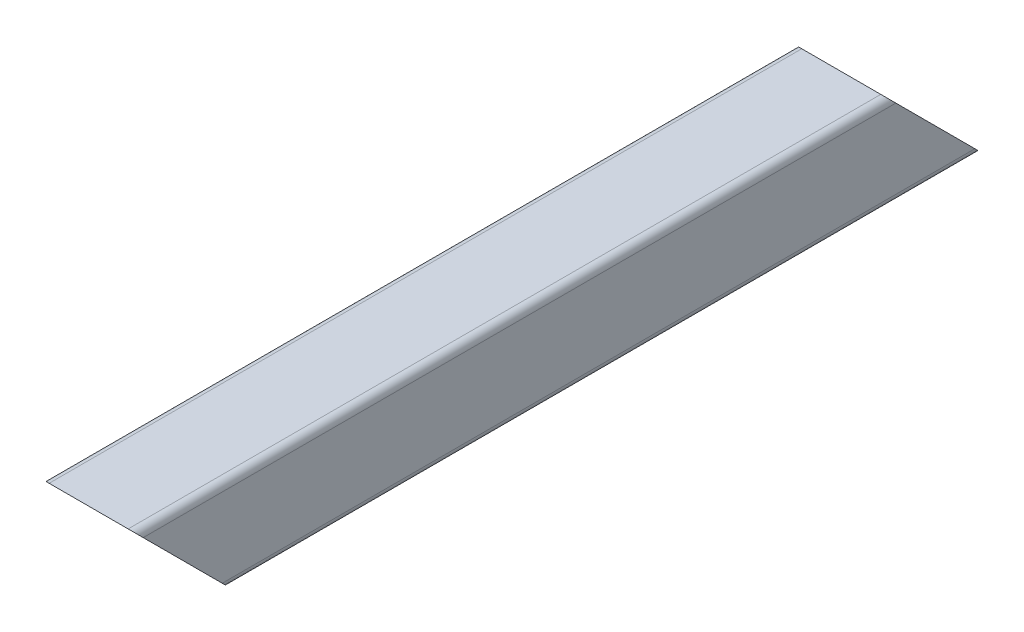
SolidWorks part; units mm, degrees
ref_plane "Face" through (0, 0, 0) normal (0, 0, 1) x (1, 0, 0)
ref_plane "Dessus" through (0, 0, 0) normal (0, 1, 0) x (1, 0, 0)
ref_plane "Droite" through (0, 0, 0) normal (1, 0, 0) x (0, 0, -1)
sketch "Esquisse1" plane through (0, 0, 0) normal (0, 0, 1) x (1, 0, 0)
  line L0 (3, -4) -> (3, -46)
  line L1 (4, 0) -> (46, 0)
  line L2 (0, -4) -> (0, -46)
  line L3 (4, -50) -> (46, -50)
  line L4 (50, -4) -> (50, -46)
  line L5 (4, -47) -> (46, -47)
  line L6 (47, -4) -> (47, -46)
  line L7 (4, -3) -> (46, -3)
  arc A0 (0, -4) -> (4, 0) centre (4, -4) cw
  arc A1 (4, -50) -> (0, -46) centre (4, -46) cw
  arc A2 (50, -46) -> (46, -50) centre (46, -46) cw
  arc A3 (46, 0) -> (50, -4) centre (46, -4) cw
  arc A4 (4, -47) -> (3, -46) centre (4, -46) cw
  arc A5 (47, -46) -> (46, -47) centre (46, -46) cw
  arc A6 (46, -3) -> (47, -4) centre (46, -4) cw
  arc A7 (3, -4) -> (4, -3) centre (4, -4) cw
  point P7 (0, 0)
  point P10 (0, -50)
  point P15 (50, 0)
  dimension "D3" = 4
  dimension "D1" = 50
  dimension "D2" = 50
  dimension "D4" = 3
extrude "Base-Extrusion" add sketch "Esquisse1" along normal blind 450
sketch "Esquisse2" plane through (0, 0, 0) normal (-1, 0, 0) x (0, 0, 1)
  line L0 (450, 0) -> (400, -50)
  line L1 (0, -50) -> (50, 0)
  line L2 (450, 0) -> (450, -50)
  line L3 (450, -50) -> (400, -50)
  line L4 (0, -50) -> (0, 0)
  line L5 (0, 0) -> (50, 0)
  line L6 (450, -4) -> (450, -46) construction
  line L7 (450, -50) -> (0, -50) construction
  line L8 (0, -4) -> (0, -46) construction
  line L9 (450, 0) -> (0, 0) construction
  dimension "D1" = 45
extrude "Enlèv. mat.-Extru.1" cut sketch "Esquisse2" against normal through all
